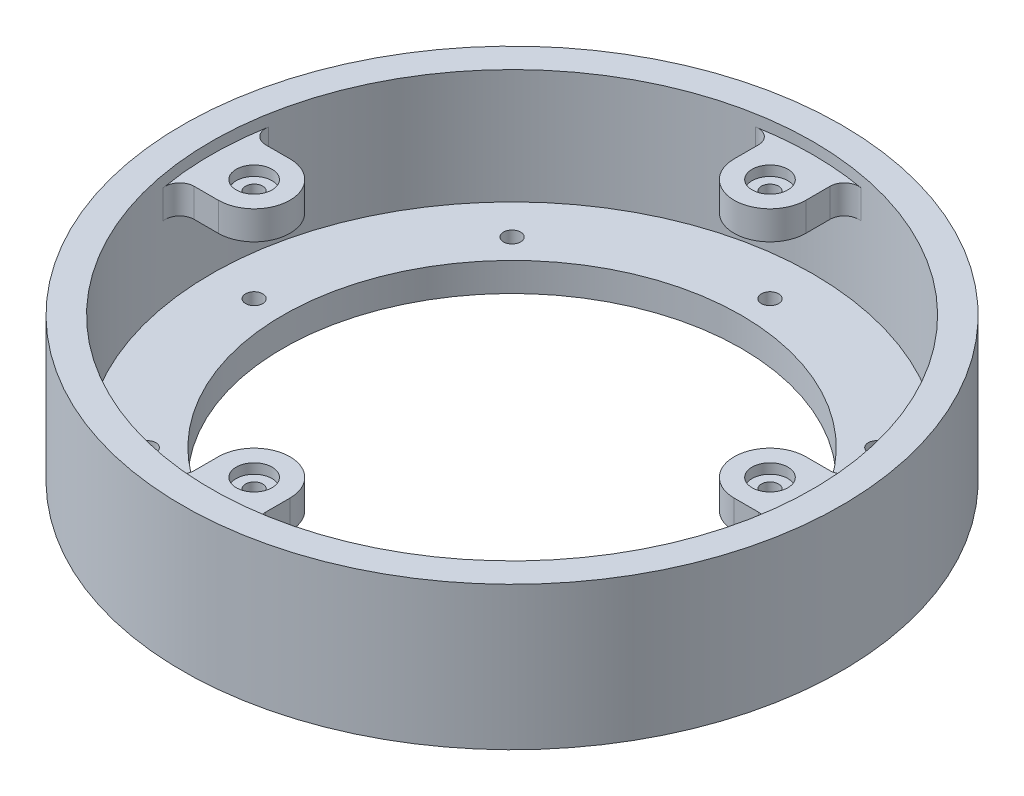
SolidWorks part; units mm, degrees
ref_plane "Front" through (0, 0, 0) normal (0, 0, 1) x (1, 0, 0)
ref_plane "Top" through (0, 0, 0) normal (0, 1, 0) x (1, 0, 0)
ref_plane "Right" through (0, 0, 0) normal (1, 0, 0) x (0, 0, -1)
imported_body "Imported1"
pattern_circular "CirPattern1" count 4 over 360 about axis through (0, 0, 0) along (0, 1, 0) of "Imported1"
pattern_circular "CirPattern2" count 8 over 360 about axis through (0, 0, 0) along (0, 1, 0) of "Imported1"
